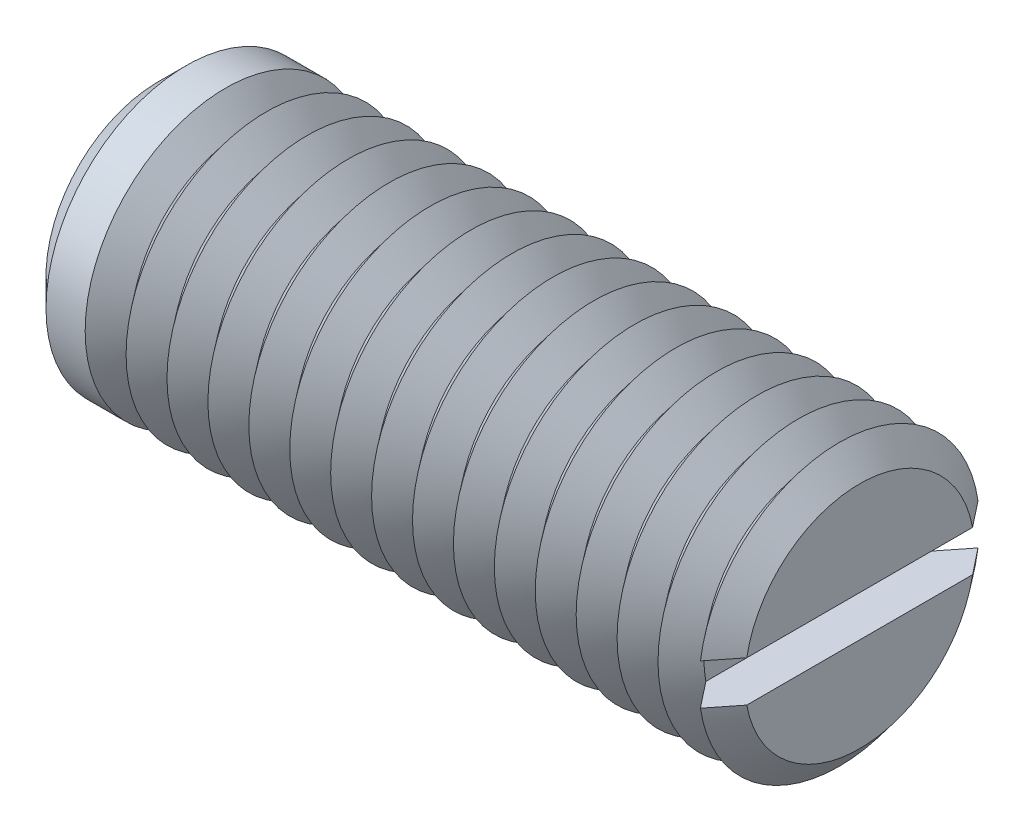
SolidWorks part; units mm, degrees
ref_plane "Front Plane" through (0, 0, 0) normal (0, 0, 1) x (1, 0, 0)
ref_plane "Top Plane" through (0, 0, 0) normal (0, 1, 0) x (1, 0, 0)
ref_plane "Right Plane" through (0, 0, 0) normal (1, 0, 0) x (0, 0, -1)
sketch "Sketch1" plane through (0, 0, 0) normal (1, 0, 0) x (0, 0, -1)
  circle A0 centre (0, 0) radius 6
  dimension "D1" = 12
extrude "Extrude1" add sketch "Sketch1" along normal mid plane 30
sketch "Sketch2" plane through (0, 0, 0) normal (0, 0, 1) x (1, 0, 0)
  line L0 (15, 0.875) -> (13.25, 0.875)
  line L1 (15, -6) -> (15, 6) construction
  line L2 (13.25, 0.875) -> (13.25, -0.875)
  line L3 (0, 0) -> (50000, 0) construction
  line L4 (15, -0.875) -> (13.25, -0.875)
  line L5 (15, -0.875) -> (15, 0.875)
  point P9 (13.25, 0)
  dimension "D1" = 1.75
extrude "Extrude2" cut sketch "Sketch2" against normal mid plane 18
chamfer "Chamfer1" distance 1.2 angle 45 1 edges at (-15, 0, -6)
sketch "Sketch3" plane through (0, 0, 0) normal (0, 0, 1) x (1, 0, 0)
  line L0 (0, 0) -> (30.9602, 0) construction
  line L1 (14.125, -6) -> (15.875, -6)
  line L2 (-13.8, -6) -> (15, -6) construction
  line L3 (15.875, -6) -> (15, -4.9071)
  line L4 (15, -6) -> (15, -0.875) construction
  line L5 (15, -4.9071) -> (14.125, -6)
  dimension "D1" = 1.75
  dimension "D2" = 1.4
revolve "Cut-Revolve1" cut sketch "Sketch3" angle 360 about L0
pattern_linear "LPattern1" count 16 spacing 1.75 along (-1, 0, 0) of "Cut-Revolve1"
equation "\"D2@Sketch3\" = \"D1@Sketch3\"*0.8"
